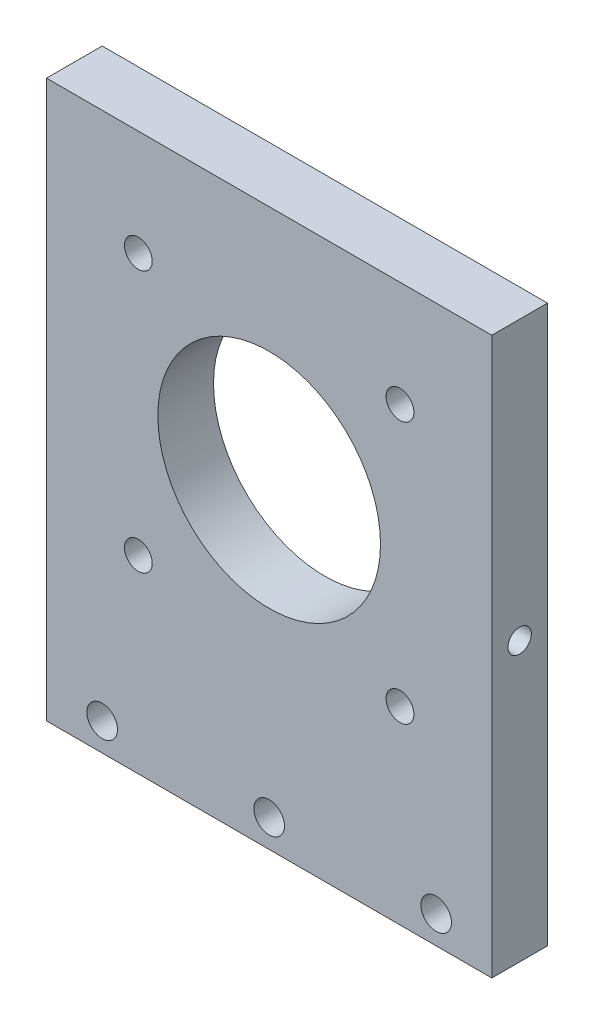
SolidWorks part; units mm, degrees
ref_plane "Спереди" through (0, 0, 0) normal (0, 0, 1) x (1, 0, 0)
ref_plane "Сверху" through (0, 0, 0) normal (0, 1, 0) x (1, 0, 0)
ref_plane "Справа" through (0, 0, 0) normal (1, 0, 0) x (0, 0, -1)
sketch "Эскиз2" plane through (0, 0, 0) normal (0, 0, 1) x (1, 0, 0)
  line L1 (40, 50) -> (-40, 50)
  line L2 (40, 50) -> (40, -50)
  line L3 (40, -50) -> (-40, -50)
  line L4 (-40, 50) -> (-40, -50)
  line L5 (40, 50) -> (-40, -50) construction
  line L6 (40, -50) -> (-40, 50) construction
  point P0 (0, 0)
  point P6 (0, -50)
  point P7 (0, 50)
  dimension "D1" = 80
  dimension "D2" = 100
extrude "Бобышка-Вытянуть1" add sketch "Эскиз2" along normal blind 10 separate body
hole_wizard "Отверстие с зазором M51" positions "Эскиз4" profile "Эскиз6" hole size "M5" standard "ISO"
sketch "Эскиз4" plane through (0, 0, 0) normal (0, 0, -1) x (-1, 0, 0)
  line L0 (40, -50) -> (-40, -50) construction
  line L1 (-40, -50) -> (-40, 50) construction
  line L2 (40, 50) -> (40, -50) construction
  point P0 (-30, -45)
  point P2 (0, -45)
  point P4 (30, -45)
  dimension "D1" = 5
  dimension "D2" = 10
  dimension "D3" = 10
  dimension "D4" = 40
sketch "Эскиз6" plane through (30, -45, 0) normal (1, 0, 0) x (0, 1, 0)
  line L0 (0, 0) -> (0, 10)
  line L1 (0, 10) -> (2.75, 10)
  line L2 (2.75, 10) -> (2.75, 0)
  line L5 (2.75, 0) -> (0, 0)
  line L11 (0, -6.35) -> (0, 107.95) construction
  dimension "Диаметр сквозного отверстия" = 5.5
  dimension "Глубина сквозного отверстия" = 10
sketch "Эскиз7" plane through (0, 0, 0) normal (0, 0, -1) x (-1, 0, 0)
  line L1 (40, -50) -> (-40, -50) construction
  line L3 (-40, -50) -> (-40, 50) construction
  circle A0 centre (0, 7.5) radius 20
  circle A4 centre (-23.5, 31) radius 2.5
  circle A5 centre (23.5, 31) radius 2.5
  circle A6 centre (23.5, -16) radius 2.5
  circle A7 centre (-23.5, -16) radius 2.5
  circle A8 centre (0, -45) radius 2.75 construction
  dimension "D1" = 40
  dimension "D3" = 40
  dimension "D4" = 40
  dimension "D5" = 47
  dimension "D9" = 5
  dimension "D2" = 57.5
  dimension "D6" = 47
  dimension "D7" = 23.5
  dimension "D8" = 23.5
extrude "Вырез-Вытянуть1" cut sketch "Эскиз7" against normal blind 10
hole_wizard "Отверстие обработанное метчиком M51" positions "Эскиз10" profile "Эскиз12" tap size "M5" standard "ISO"
sketch "Эскиз10" plane through (40, 0, 0) normal (1, 0, 0) x (0, 0, -1)
  point P0 (-5, 0)
sketch "Эскиз12" plane through (40, 0, 5) normal (0, 1, 0) x (0, 0, -1)
  line L0 (0, 0) -> (0, 11.2618)
  line L1 (0, 11.2618) -> (2.1, 10)
  line L2 (2.1, 10) -> (2.1, 0)
  line L5 (2.1, 0) -> (0, 0)
  line L10 (0, 11.2618) -> (-2.1, 10) construction
  line L11 (0, -6.35) -> (0, 107.95) construction
  dimension "Диаметр сверла" = 4.2
  dimension "Глубина сверла" = 10
  dimension "Угол заточки сверла" = 118
hole_wizard "Отверстие обработанное метчиком M52" positions "Эскиз13" profile "Эскиз14" tap size "M5" standard "ISO"
sketch "Эскиз13" plane through (-40, 0, 0) normal (-1, 0, 0) x (0, 0, 1)
  line L0 (10, 50) -> (0, 50) construction
  line L1 (0, 50) -> (0, -50) construction
  point P0 (5, 0)
  dimension "D1" = 50
  dimension "D2" = 5
sketch "Эскиз14" plane through (-40, 0, 5) normal (0, 1, 0) x (0, 0, 1)
  line L0 (0, 0) -> (0, 11.2618)
  line L1 (0, 11.2618) -> (2.1, 10)
  line L2 (2.1, 10) -> (2.1, 0)
  line L5 (2.1, 0) -> (0, 0)
  line L10 (0, 11.2618) -> (-2.1, 10) construction
  line L11 (0, -6.35) -> (0, 107.95) construction
  dimension "Диаметр сверла" = 4.2
  dimension "Глубина сверла" = 10
  dimension "Угол заточки сверла" = 118
